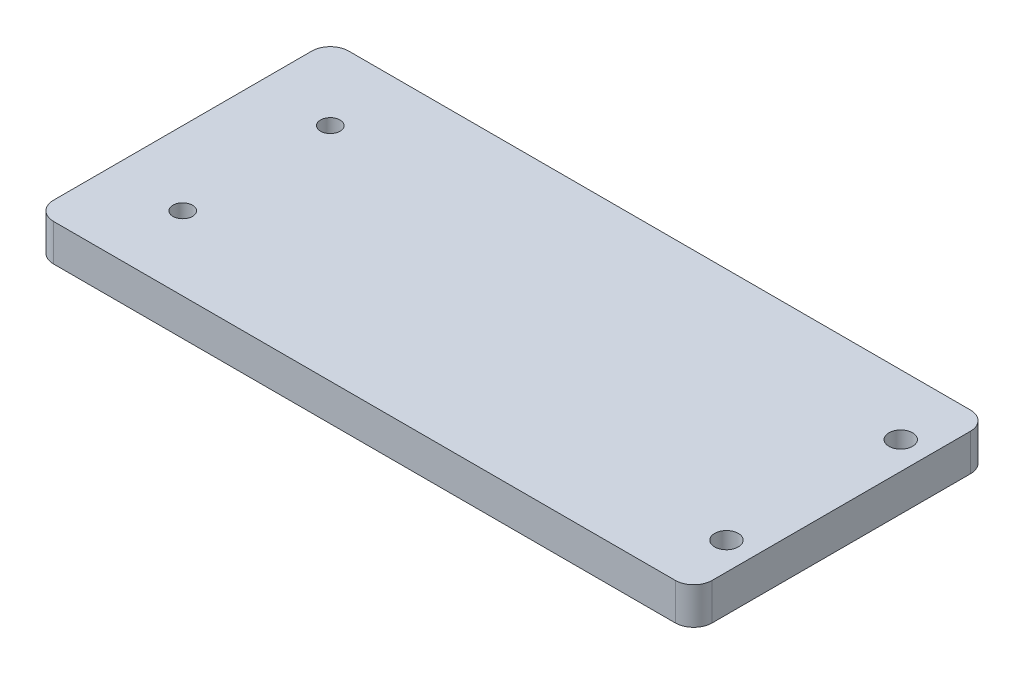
SolidWorks part; units mm, degrees
ref_plane "Front Plane" through (0, 0, 0) normal (0, 0, 1) x (1, 0, 0)
ref_plane "Top Plane" through (0, 0, 0) normal (0, 1, 0) x (1, 0, 0)
ref_plane "Right Plane" through (0, 0, 0) normal (1, 0, 0) x (0, 0, -1)
sketch "Sketch1" plane through (0, 0, 0) normal (0, 1, 0) x (1, 0, 0)
  line L1 (0, 0) -> (226.7204, 0)
  line L2 (0, 0) -> (0, 101.6)
  line L3 (0, 101.6) -> (226.7204, 101.6)
  line L4 (226.7204, 0) -> (226.7204, 101.6)
  dimension "D1" = 226.7204
  dimension "D2" = 101.6
extrude "Boss-Extrude1" add sketch "Sketch1" against normal blind 12.7
sketch "Sketch2" plane through (0, 0, 0) normal (0, 1, 0) x (1, 0, 0)
  line L0 (0, 101.6) -> (0, 0) construction
  line L1 (0, 0) -> (226.7204, 0) construction
  line L2 (226.7204, 0) -> (226.7204, 101.6) construction
  circle A0 centre (25.4, 76.2) radius 3.3655
  circle A1 centre (25.4, 25.4) radius 3.3655
  circle A2 centre (217.1954, 80.7974) radius 4.064
  circle A3 centre (217.1954, 20.8026) radius 4.064
  dimension "D5" = 6.731
  dimension "D6" = 6.731
  dimension "D11" = 8.128
  dimension "D12" = 8.128
  dimension "D1" = 25.4
  dimension "D2" = 25.4
  dimension "D3" = 50.8
  dimension "D4" = 25.4
  dimension "D7" = 9.525
  dimension "D8" = 9.525
  dimension "D9" = 59.9948
  dimension "D10" = 20.8026
extrude "Cut-Extrude1" cut sketch "Sketch2" against normal through all
fillet "Fillet1" radius 6.35 4 edges at (226.7204, -6.35, 0) (226.7204, -6.35, -101.6) (0, -6.35, 0) (0, -6.35, -101.6)
